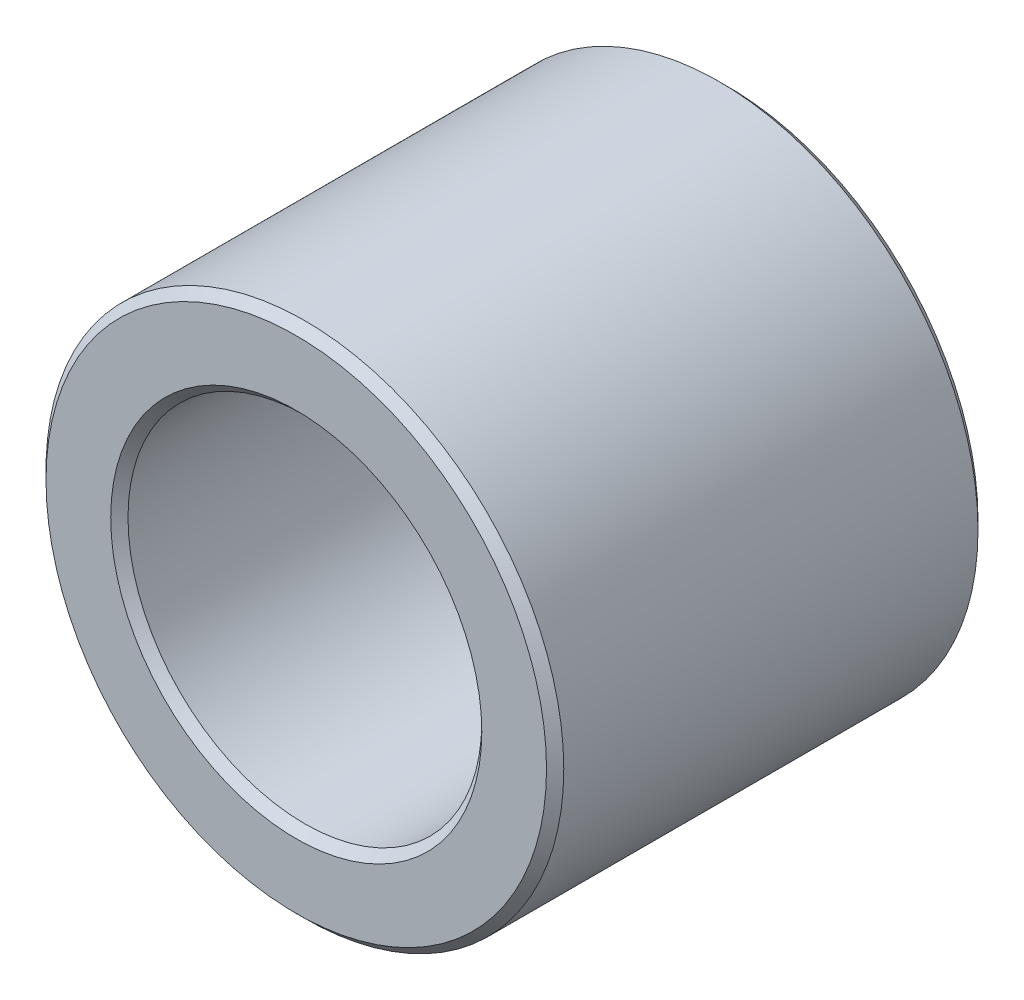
SolidWorks part; units mm, degrees
ref_plane "Front Plane" through (0, 0, 0) normal (0, 0, 1) x (1, 0, 0)
ref_plane "Top Plane" through (0, 0, 0) normal (0, 1, 0) x (1, 0, 0)
ref_plane "Right Plane" through (0, 0, 0) normal (1, 0, 0) x (0, 0, -1)
sketch "Sketch1" plane through (0, 0, 0) normal (0, 0, 1) x (1, 0, 0)
  circle A0 centre (0, 0) radius 6
  circle A1 centre (0, 0) radius 4.1
  dimension "D1" = 12
  dimension "D2" = 8.2
extrude "Boss-Extrude2" add sketch "Sketch1" along normal mid plane 10
chamfer "Chamfer3" distance 0.2 angle 45 4 edges at (6, 0, 5) (6, 0, -5) (4.1, 0, -5) (4.1, 0, 5)
